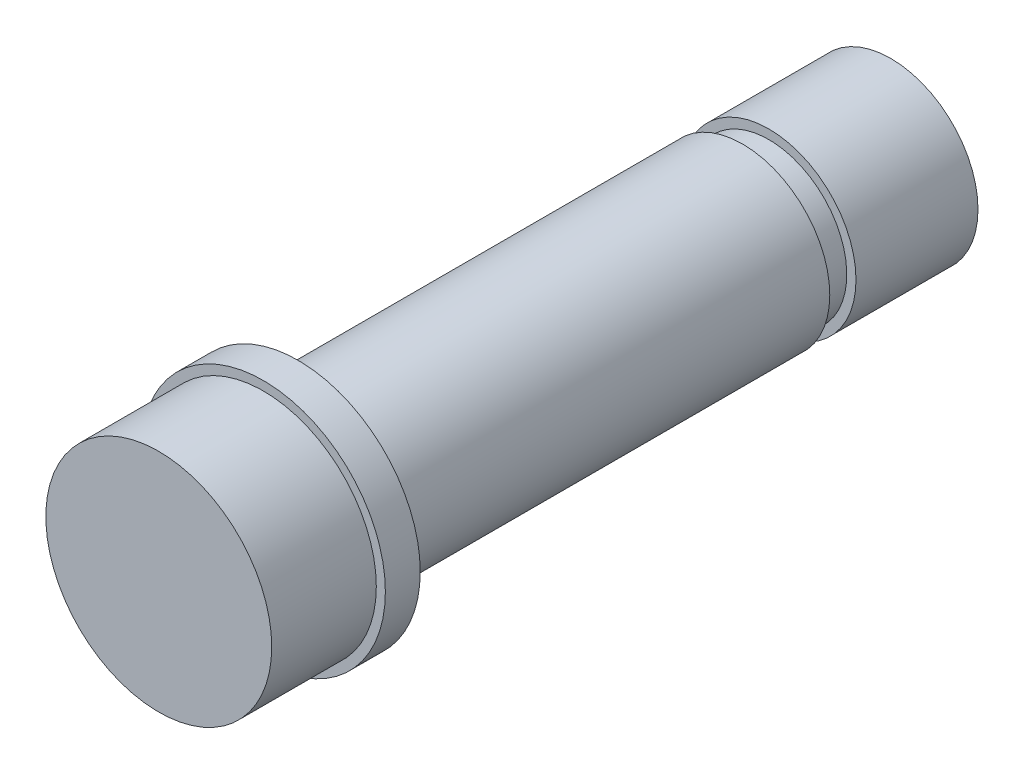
SolidWorks part; units mm, degrees
ref_plane "Front" through (0, 0, 0) normal (0, 0, 1) x (1, 0, 0)
ref_plane "Top" through (0, 0, 0) normal (0, 1, 0) x (1, 0, 0)
ref_plane "Right" through (0, 0, 0) normal (1, 0, 0) x (0, 0, -1)
sketch "Sketch1" plane through (0, 0, 0) normal (1, 0, 0) x (0, 0, -1)
  line L0 (0, 7.9375) -> (0, 11.1125)
  line L1 (0, 11.1125) -> (-3.175, 11.1125)
  line L2 (-3.175, 11.1125) -> (-3.175, 10.287)
  line L3 (-3.175, 10.287) -> (-12.7, 10.287)
  line L4 (-12.7, 10.287) -> (-12.7, 0)
  line L5 (-12.7, 7.9375) -> (-3.048, 7.9375) construction
  line L7 (-6.8286, 0) -> (-12.7, 0)
  line L8 (-3.048, 6.5481) -> (53.975, 6.5481)
  line L9 (53.975, 6.5481) -> (53.975, 7.9375)
  line L10 (53.975, 7.9375) -> (0, 7.9375)
  line L11 (0, 0) -> (43.4699, 0) construction
  line L12 (-3.048, 6.5481) -> (-3.048, 7.9375) construction
  line L13 (-3.048, 6.5481) -> (-6.8286, 0)
  dimension "D1" = 7.9375
  dimension "D2" = 13.0962
  dimension "D3" = 20.574
  dimension "D4" = 22.225
  dimension "D5" = 15.875
  dimension "D6" = 9.652
  dimension "D7" = 3.175
  dimension "D8" = 53.975
  dimension "D9" = 9.525
  dimension "D10" = 60
revolve "Revolve2" add sketch "Sketch1" angle 360 about L11
sketch "#2-017" plane through (0, 0, 0) normal (1, 0, 0) x (0, 0, -1)
  line L0 (0, -11.1125) -> (0, 11.1125) construction
  line L1 (0, 8.5852) -> (-1.27, 8.5852)
  line L2 (0, 8.5852) -> (0, 10.7188)
  line L3 (0, 10.7188) -> (-1.27, 10.7188)
  line L4 (-1.27, 8.5852) -> (-1.27, 10.7188)
  line L5 (0, 0) -> (16.1062, 0) construction
  line L6 (53.975, 0) -> (0, 0) construction
  circle A0 centre (-0.381, 9.4742) radius 0.889 construction
  dimension "D4" = 1.778
  dimension "D1" = 17.1704
  dimension "D2" = 2.1336
  dimension "D3" = 1.27
revolve "Cut-Revolve1" cut sketch "#2-017" angle 360 about L5
sketch "Sketch3" plane through (0, 0, 0) normal (1, 0, 0) x (0, 0, -1)
  line L0 (53.975, 7.9375) -> (0, 7.9375) construction
  line L1 (40.4749, 7.9375) -> (42.8625, 7.9375)
  line L2 (40.4749, 7.9375) -> (40.4749, 7.098)
  line L3 (40.4749, 7.098) -> (42.8625, 7.098)
  line L4 (42.8625, 7.9375) -> (42.8625, 7.098)
  line L5 (0, 0) -> (58.5429, 0) construction
  line L6 (0, -11.1125) -> (0, 11.1125) construction
  line L7 (53.975, 0) -> (0, 0) construction
  line L8 (53.975, 6.5481) -> (-3.048, 6.5481) construction
  line L9 (53.975, 6.5481) -> (-3.048, 6.5481) construction
  line L10 (53.975, -7.9375) -> (53.975, 7.9375) construction
  dimension "D1" = 2.3876
  dimension "D2" = 14.1961
  dimension "D3" = 11.1125
  dimension "D4" = 15.875
revolve "Cut-Revolve3" cut sketch "Sketch3" angle 360 about L5
sketch "Sketch4" plane through (0, 0, 0) normal (1, 0, 0) x (0, 0, -1)
  line L0 (-12.7, 10.287) -> (-12.7, -10.287) construction
  line L1 (-12.7, 7.9375) -> (-3.048, 7.9375)
  line L2 (-12.7, 7.9375) -> (-12.7, 0)
  line L3 (-12.7, 0) -> (-3.048, 0)
  line L4 (-3.048, 7.9375) -> (-3.048, 0)
  line L5 (-3.175, 0) -> (-12.7, 0) construction
  line L6 (0, 0) -> (-3.175, 0) construction
  line L7 (0, 0) -> (7.1271, 0) construction
  line L8 (40.4749, 0) -> (0, 0) construction
  dimension "D1" = 9.652
  dimension "D2" = 15.875
revolve "Cut-Revolve4" [suppressed] cut sketch "Sketch4" angle 360 about L7
sketch "Sketch5" [suppressed] plane through (0, 0, 0) normal (1, 0, 0) x (0, 0, -1)
  line L0 (0, 0) -> (-20.7498, 0) construction
  line L1 (-3.175, 0) -> (-12.7, 0) construction
  line L2 (40.4749, 0) -> (0, 0) construction
  line L3 (-12.7, 9.5885) -> (-12.0015, 10.287)
  line L4 (-12.7, 10.287) -> (-12.7, -10.287) construction
  line L5 (-12.0015, 10.287) -> (-12.7, 10.287)
  line L6 (-12.7, 10.287) -> (-12.7, 9.5885)
  line L7 (-3.048, 7.9375) -> (-12.7, 7.9375) construction
  line L8 (-3.175, 10.287) -> (-12.7, 10.287) construction
  dimension "D1" = 1.651
  dimension "D2" = 45
revolve "Cut-Revolve5" [suppressed] cut sketch "Sketch5" angle 360 about L0
fillet "Fillet1" [suppressed] radius 0.127
fillet "Fillet2" [suppressed] radius 0.127
fillet "Fillet3" [suppressed] radius 0.127
fillet "Fillet4" [suppressed] radius 0.127
fillet "Fillet5" [suppressed] radius 0.127
fillet "Fillet6" [suppressed] radius 0.127
